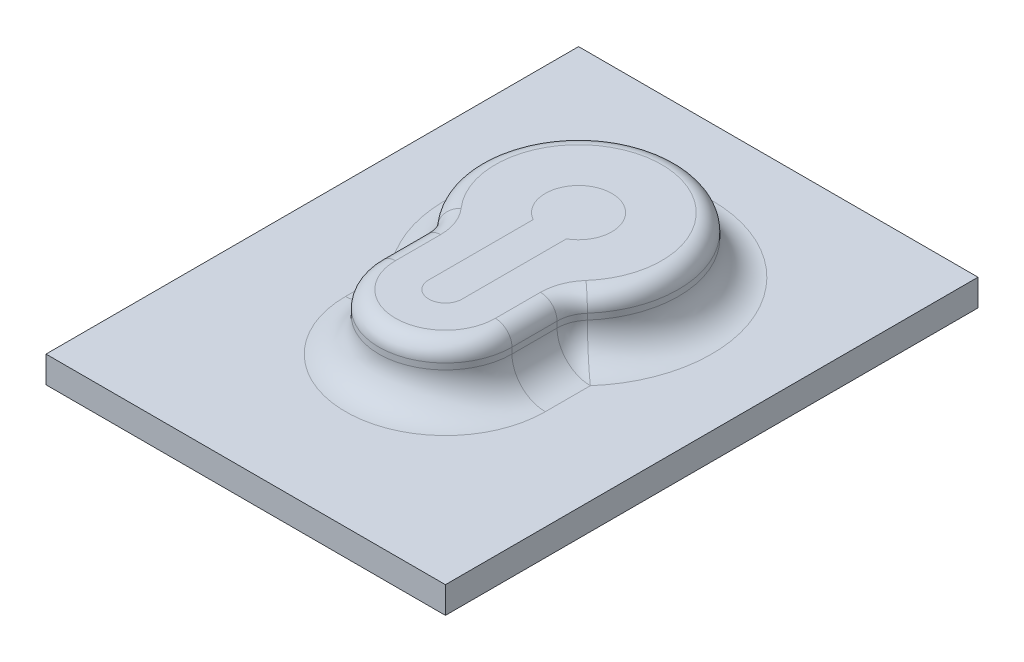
SolidWorks part; units mm, degrees
ref_plane "Front Plane" through (0, 0, 0) normal (0, 0, 1) x (1, 0, 0)
ref_plane "Top Plane" through (0, 0, 0) normal (0, 1, 0) x (1, 0, 0)
ref_plane "Right Plane" through (0, 0, 0) normal (1, 0, 0) x (0, 0, -1)
sketch "Sketch1" plane through (0, 0, 0) normal (0, 1, 0) x (1, 0, 0)
  line L1 (19.05, 19.05) -> (-19.05, 19.05)
  line L2 (19.05, 19.05) -> (19.05, -31.75)
  line L3 (19.05, -31.75) -> (-19.05, -31.75)
  line L4 (-19.05, 19.05) -> (-19.05, -31.75)
  line L5 (19.05, 19.05) -> (-19.05, -31.75) construction
  line L6 (19.05, -31.75) -> (-19.05, 19.05) construction
  point P0 (0, -6.35)
  dimension "D1" = 50.8
  dimension "D2" = 38.1
  dimension "D3" = 6.35
extrude "Boss-Extrude1" add sketch "Sketch1" along normal blind 2.54
sketch "Sketch2" plane through (0, 2.54, 0) normal (0, 1, 0) x (1, 0, 0)
  line L0 (0, 0) -> (0, -12.7) construction
  line L1 (6.35, -8.4003) -> (6.35, -12.7)
  line L2 (-6.35, -8.4003) -> (-6.35, -12.7)
  arc A0 (6.35, -8.4003) -> (7.1437, -6.3002) centre (9.525, -8.4003) cw
  arc A1 (-6.35, -12.7) -> (6.35, -12.7) centre (0, -12.7) ccw
  arc A2 (7.1437, -6.3002) -> (-7.1438, -6.3002) centre (0, 0) ccw
  arc A3 (-7.1438, -6.3002) -> (-6.35, -8.4003) centre (-9.525, -8.4003) cw
  point P3 (0, -12.7)
  dimension "D1" = 6.35
  dimension "D2" = 9.525
  dimension "D4" = 3.175
  dimension "D3" = 12.7
extrude "Boss-Extrude2" add sketch "Sketch2" along normal blind 5.334
fillet "Fillet1" radius 3.175 6 edges at (-6.35, 2.54, 10.5501) (-6.5551, 2.54, 7.2777) (0, 2.54, -9.525) (6.5551, 2.54, 7.2777) (6.35, 2.54, 10.5501) (0, 2.54, 19.05)
fillet "Fillet2" radius 1.5875 6 edges at (-6.35, 7.874, 10.5501) (-6.5551, 7.874, 7.2777) (0, 7.874, -9.525) (6.5551, 7.874, 7.2777) (6.35, 7.874, 10.5501) (0, 7.874, 19.05)
sketch "Sketch3" plane through (0, 7.874, 0) normal (0, 1, 0) x (1, 0, 0)
  line L0 (0, -12.7) -> (0, 0) construction
  line L1 (-1.5875, -12.7) -> (-1.5875, -2.7496)
  line L2 (1.5875, -12.7) -> (1.5875, -2.7496)
  arc A0 (-1.5875, -12.7) -> (1.5875, -12.7) centre (0, -12.7) ccw
  arc A2 (1.5875, -2.7496) -> (-1.5875, -2.7496) centre (0, 0) ccw
  dimension "D2" = 6.35
  dimension "D1" = 3.175
sketch "Orientation Sketch" plane through (0, 2.54, 0) normal (0, 1, 0) x (1, 0, 0)
  line L0 (-9.525, -12.7) -> (-9.525, -8.4003) construction
  line L1 (9.525, -8.4003) -> (9.525, -12.7) construction
  line L2 (-19.05, 19.05) -> (-19.05, -31.75) construction
  line L3 (-19.05, -31.75) -> (19.05, -31.75) construction
  line L4 (19.05, -31.75) -> (19.05, 19.05) construction
  line L5 (19.05, 19.05) -> (-19.05, 19.05) construction
  line L6 (-9.525, -12.7) -> (-9.525, -8.4003)
  line L7 (9.525, -8.4003) -> (9.525, -12.7)
  line L8 (-19.05, 19.05) -> (-19.05, -31.75) construction
  line L9 (-19.05, -31.75) -> (19.05, -31.75) construction
  line L10 (19.05, -31.75) -> (19.05, 19.05) construction
  line L11 (19.05, 19.05) -> (-19.05, 19.05) construction
  arc A0 (-9.525, -12.7) -> (9.525, -12.7) centre (0, -12.7) ccw construction
  arc A1 (9.525, -8.4003) -> (-9.525, -8.4003) centre (0, 0) ccw construction
  arc A2 (-9.525, -12.7) -> (9.525, -12.7) centre (0, -12.7) ccw
  arc A3 (9.525, -8.4003) -> (-9.525, -8.4003) centre (0, 0) ccw
  point P8 (0, 0)
other "FormTool1"
